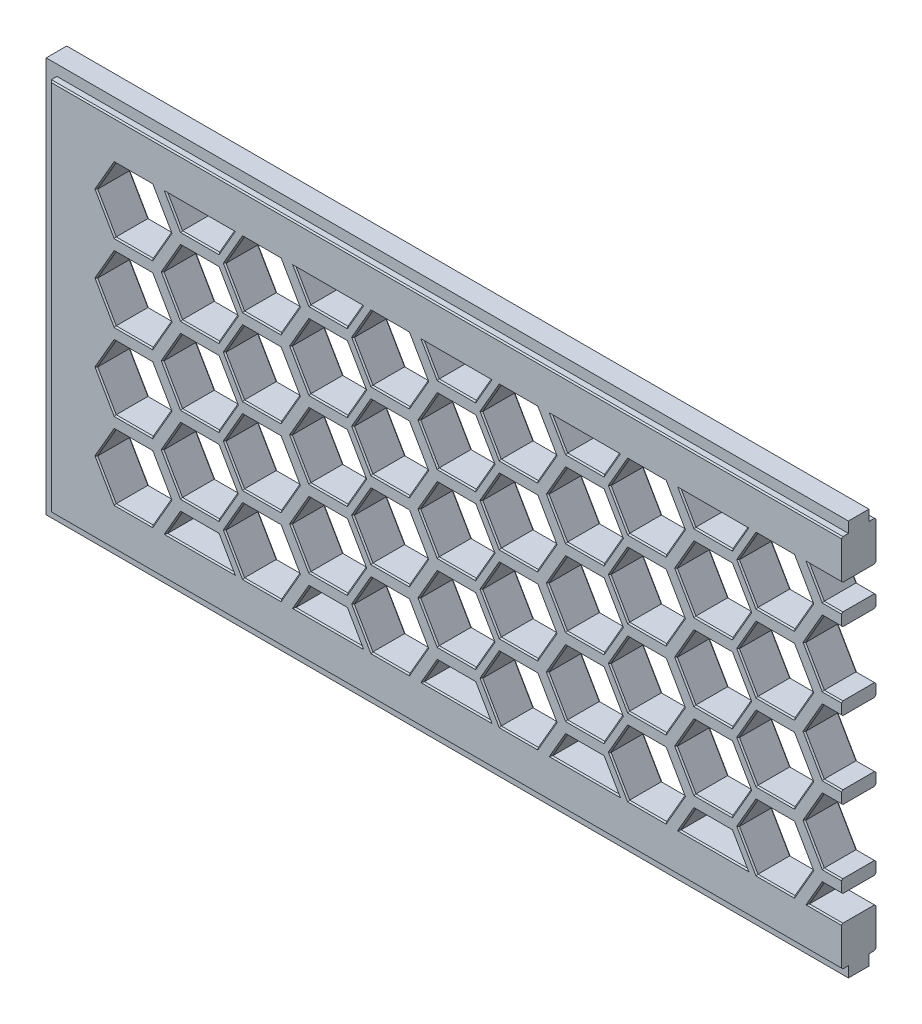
SolidWorks part; units mm, degrees
ref_plane "Aufriss" through (0, 0, 0) normal (0, 0, 1) x (1, 0, 0)
ref_plane "Grundriss" through (0, 0, 0) normal (0, 1, 0) x (1, 0, 0)
ref_plane "Seitenriss" through (0, 0, 0) normal (1, 0, 0) x (0, 0, -1)
sketch "Skizze1" plane through (0, 0, 0) normal (0, 0, 1) x (1, 0, 0)
  line L1 (-192, -43.75) -> (192, -43.75)
  line L2 (-192, -43.75) -> (-192, 43.75)
  line L3 (-192, 43.75) -> (192, 43.75)
  line L4 (192, -43.75) -> (192, 43.75)
  line L5 (-192, -43.75) -> (192, 43.75) construction
  line L6 (-192, 43.75) -> (192, -43.75) construction
  point P0 (0, 0)
  dimension "D1" = 384
  dimension "D2" = 87.5
extrude "Aufsatz-Linear austragen1" add sketch "Skizze1" along normal mid plane 8
sketch "Skizze2" plane through (0, 0, 4) normal (0, 0, 1) x (1, 0, 0)
  line L0 (-192, 43.75) -> (-192, -43.75) construction
  line L1 (-168.1699, 34.5) -> (-176.8301, 34.5)
  line L2 (-176.8301, 34.5) -> (-181.1603, 27)
  line L3 (-181.1603, 27) -> (-176.8301, 19.5)
  line L4 (-176.8301, 19.5) -> (-168.1699, 19.5)
  line L5 (-168.1699, 19.5) -> (-163.8397, 27)
  line L6 (-163.8397, 27) -> (-168.1699, 34.5)
  line L7 (192, 43.75) -> (-192, 43.75) construction
  circle A0 centre (-172.5, 27) radius 7.5 construction
  dimension "D1" = 19.5
  dimension "D2" = 16.75
  dimension "D3" = 15
extrude "Schnitt-Linear austragen1" cut sketch "Skizze2" against normal through all
pattern_linear "Lineares Muster1" count 12 spacing 30 along (1, 0, 0) count 4 spacing 18 along (0, -1, 0) of "Schnitt-Linear austragen1"
sketch "Skizze3" plane through (0, 0, 4) normal (0, 0, 1) x (1, 0, 0)
  line L0 (-168.1699, 34.5) -> (-176.8301, 34.5) construction
  line L1 (-161.3301, 25.5) -> (-165.6603, 18)
  line L2 (-165.6603, 18) -> (-161.3301, 10.5)
  line L3 (-161.3301, 10.5) -> (-152.6699, 10.5)
  line L4 (-152.6699, 10.5) -> (-148.3397, 18)
  line L5 (-148.3397, 18) -> (-152.6699, 25.5)
  line L6 (-152.6699, 25.5) -> (-161.3301, 25.5)
  line L7 (-192, 43.75) -> (-192, -43.75) construction
  line L8 (192, 43.75) -> (-192, 43.75) construction
  circle A0 centre (-157, 18) radius 7.5 construction
  dimension "D1" = 35
  dimension "D2" = 25.75
extrude "Schnitt-Linear austragen2" cut sketch "Skizze3" against normal through all
pattern_linear "Lineares Muster2" count 12 spacing 30 along (1, 0, 0) count 4 spacing 18 along (0, -1, 0) of "Schnitt-Linear austragen2"
pattern_linear "Lineares Muster3" count 2 spacing 18 along (0, 1, 0) count 25 spacing 30 along (1, 0, 0) of "Schnitt-Linear austragen2"
sketch "Skizze4" plane through (0, 0, 4) normal (0, 0, 1) x (1, 0, 0)
  line L0 (192, -43.75) -> (192, 43.75) construction
  line L1 (-192, 43.75) -> (192, 43.75)
  line L3 (-192, 34.5) -> (192, 34.5)
  line L4 (192, 43.75) -> (192, 34.5)
  line L5 (-192, 43.75) -> (-192, -43.75) construction
  line L6 (192, -43.75) -> (-192, -43.75)
  line L7 (192, -43.75) -> (192, -34.5)
  line L8 (192, -34.5) -> (-192, -34.5)
  line L9 (-192, -43.75) -> (-192, -34.5)
  line L11 (-176.8301, -34.5) -> (-168.1699, -34.5) construction
  line L12 (-168.1699, 34.5) -> (-176.8301, 34.5) construction
  line L14 (-192, 34.5) -> (-192, 43.75)
extrude "Aufsatz-Linear austragen2" add sketch "Skizze4" against normal up to surface (8 mm away)
sketch "Skizze5" plane through (0, 0, 0) normal (0, 0, 1) x (1, 0, 0)
  line L1 (-192, 43.75) -> (192, 43.75)
  line L2 (-192, 43.75) -> (-192, -43.75)
  line L3 (-192, -43.75) -> (192, -43.75)
  line L4 (192, 43.75) -> (192, -43.75)
  line L5 (-194.5, 46.25) -> (194.5, 46.25)
  line L6 (-194.5, 46.25) -> (-194.5, -46.25)
  line L7 (-194.5, -46.25) -> (194.5, -46.25)
  line L8 (194.5, 46.25) -> (194.5, -46.25)
  dimension "D1" = 2.5
  dimension "D2" = 2.5
  dimension "D3" = 2.5
  dimension "D4" = 2.5
extrude "Aufsatz-Linear austragen3" add sketch "Skizze5" along normal mid plane 4.8
sketch "Skizze7" plane through (0, 0, 4) normal (0, 0, 1) x (1, 0, 0)
  line L0 (192, -43.75) -> (192, 43.75) construction
  line L1 (139.7, -28.25) -> (133.1, -21.65)
  line L2 (179, -28.25) -> (139.7, -28.25)
  line L3 (139.7, 0.75) -> (179, 0.75)
  line L4 (133.1, -5.85) -> (139.7, 0.75)
  line L5 (133.1, -13.75) -> (182, -13.75) construction
  line L12 (-192, -43.75) -> (192, -43.75) construction
  line L14 (133.1, -21.65) -> (139.7, -28.25)
  line L15 (139.7, -28.25) -> (179, -28.25)
  line L16 (182, -25.25) -> (182, -2.25)
  line L17 (179, 0.75) -> (139.7, 0.75)
  line L18 (139.7, 0.75) -> (133.1, -5.85)
  line L19 (133.1, -5.85) -> (133.1, -21.65)
  arc A0 (182, -25.25) -> (179, -28.25) centre (179, -25.25) cw
  arc A1 (179, 0.75) -> (182, -2.25) centre (179, -2.25) cw
  circle A2 centre (157.55, 6.25) radius 2
  circle A3 centre (157.55, -33.75) radius 2
  arc A8 (179, -28.25) -> (182, -25.25) centre (179, -25.25) ccw
  arc A9 (182, -2.25) -> (179, 0.75) centre (179, -2.25) ccw
  dimension "D2" = 29
  dimension "D4" = 5.5
  dimension "D8" = 45
  dimension "D3" = 24.45
  dimension "D5" = 5.5
  dimension "D7" = 3
  dimension "D11" = 4
  dimension "D1" = 48.9
  dimension "D6" = 10
  dimension "D9" = 6.6
  dimension "D10" = 30
extrude "Schnitt-Linear austragen3" cut sketch "Skizze7" against normal through all contours L19 L5 L16 A1 L3 L4 | A2 | L5 L19 L1 L2 A0 L16 | A3
sketch "Skizze6" plane through (0, 0, 4) normal (0, 0, 1) x (1, 0, 0)
  line L0 (194.5, 46.25) -> (-194.5, 46.25) construction
  line L1 (67.5, -46.25) -> (194.5, -46.25)
  line L2 (67.5, -46.25) -> (67.5, 46.25)
  line L3 (67.5, 46.25) -> (194.5, 46.25)
  line L4 (194.5, -46.25) -> (194.5, 46.25)
  line L8 (71.8301, 34.5) -> (63.1699, 34.5) construction
  point P0 (0, 0)
  point P10 (67.5, 34.5)
chamfer "Fase1" distance 0.3 angle 45
sketch "Skizze8" plane through (0, 0, 4) normal (0, 0, 1) x (1, 0, 0)
  line L0 (-194.5, -46.25) -> (194.5, -46.25) construction
  line L1 (194.5, 46.25) -> (-7, 46.25)
  line L2 (194.5, 46.25) -> (194.5, -46.25)
  line L3 (194.5, -46.25) -> (-7, -46.25)
  line L4 (-7, 46.25) -> (-7, -46.25)
  line L5 (-11.5033, 25.8) -> (-2.4967, 25.8) construction
  point P9 (-7, 25.8)
extrude "Schnitt-Linear austragen4" cut sketch "Skizze8" against normal through all
